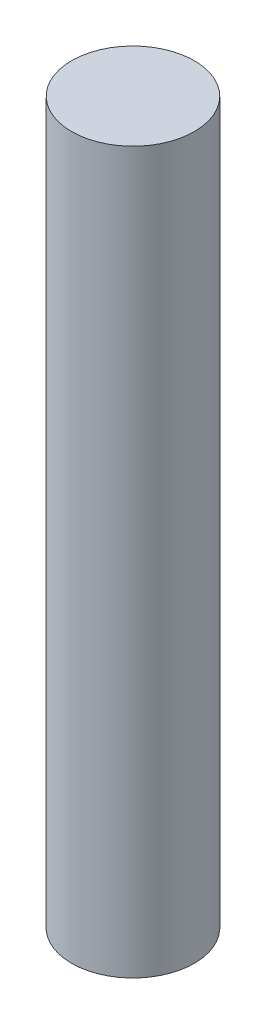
SolidWorks part; units mm, degrees
ref_plane "Front Plane" through (0, 0, 0) normal (0, 0, 1) x (1, 0, 0)
ref_plane "Top Plane" through (0, 0, 0) normal (0, 1, 0) x (1, 0, 0)
ref_plane "Right Plane" through (0, 0, 0) normal (1, 0, 0) x (0, 0, -1)
sketch "Sketch1" plane through (0, 0, 0) normal (0, 1, 0) x (1, 0, 0)
  circle A0 centre (0, 0) radius 4.7625
  dimension "D1" = 9.525
extrude "Boss-Extrude1" add sketch "Sketch1" along normal mid plane 55.88
